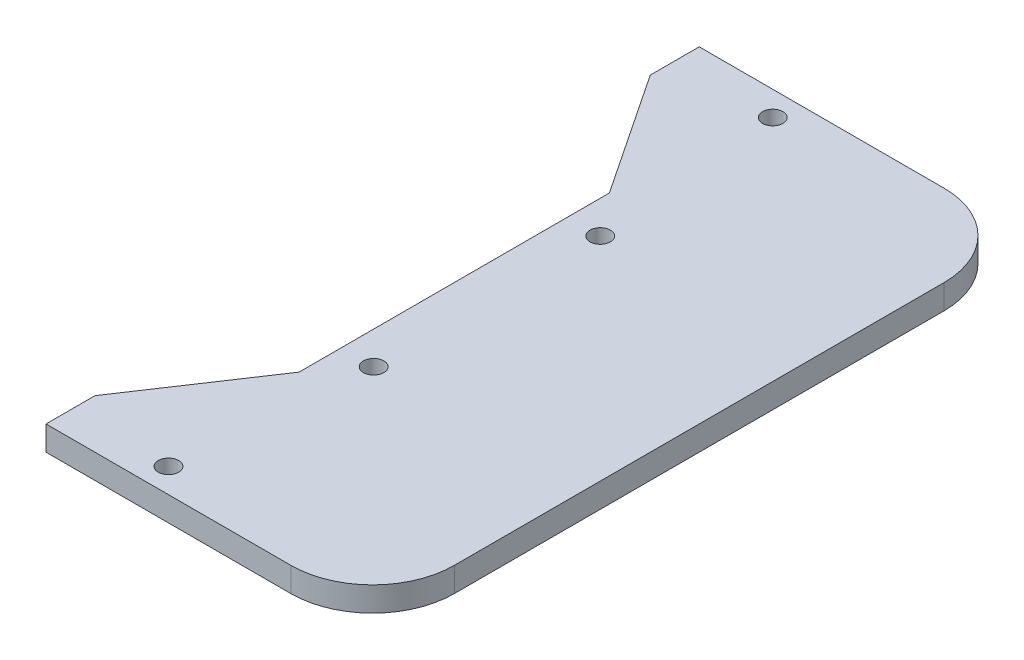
SolidWorks part; units mm, degrees
ref_plane "Front Plane" through (0, 0, 0) normal (0, 0, 1) x (1, 0, 0)
ref_plane "Top Plane" through (0, 0, 0) normal (0, 1, 0) x (1, 0, 0)
ref_plane "Right Plane" through (0, 0, 0) normal (1, 0, 0) x (0, 0, -1)
sketch "Sketch1" plane through (0, 0, 0) normal (0, 1, 0) x (1, 0, 0)
  line L0 (0, 0) -> (27057.8557, 0) construction
  line L1 (0, 19) -> (0, -19)
  line L2 (-10, 40) -> (-10, -32.1866) construction
  line L3 (-10, 40) -> (20, 40)
  line L4 (30, 30) -> (30, -30)
  line L5 (-10, 40) -> (-10, 34)
  line L6 (-10, 34) -> (0, 19)
  line L7 (-10, -40) -> (20, -40)
  line L8 (-10, -40) -> (-10, -34)
  line L9 (-10, -34) -> (0, -19)
  arc A0 (20, 40) -> (30, 30) centre (20, 30) cw
  circle A1 centre (2, 37) radius 1.25
  circle A2 centre (4, 13.87) radius 1.25
  arc A3 (20, -40) -> (30, -30) centre (20, -30) ccw
  circle A4 centre (2, -37) radius 1.25
  circle A5 centre (4, -13.87) radius 1.25
  point P6 (0, 0)
  point P13 (30, 40)
  point P20 (30, 0)
  dimension "D6" = 10
  dimension "D9" = 2.5
  dimension "D11" = 2.5
  dimension "D1" = 38
  dimension "D2" = 10
  dimension "D3" = 40
  dimension "D4" = 40
  dimension "D5" = 6
  dimension "D7" = 12
  dimension "D8" = 3
  dimension "D10" = 27.74
  dimension "D12" = 4
extrude "Boss-Extrude1" add sketch "Sketch1" along normal blind 3
